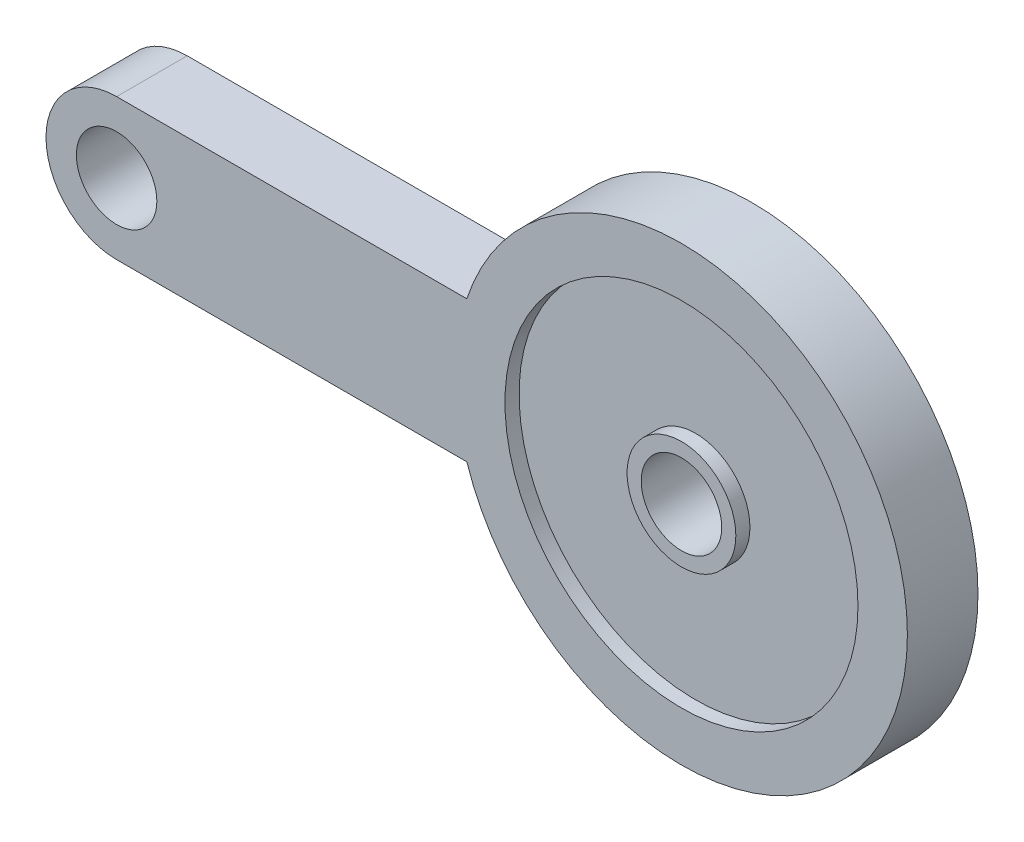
SolidWorks part; units mm, degrees
ref_plane "Front Plane" through (0, 0, 0) normal (0, 0, 1) x (1, 0, 0)
ref_plane "Top Plane" through (0, 0, 0) normal (0, 1, 0) x (1, 0, 0)
ref_plane "Right Plane" through (0, 0, 0) normal (1, 0, 0) x (0, 0, -1)
imported_body "Imported1"
sketch "Sketch1" plane through (0, 0, 2.5) normal (0, 0, 1) x (1, 0, 0)
  line L0 (28.1064, 13.7944) -> (36.8722, 25.1152)
  line L1 (36.8722, 25.1152) -> (61.5599, -12.109)
  line L2 (61.5599, -12.109) -> (17.871, -31.4121)
  line L3 (17.871, -31.4121) -> (13.4901, -14.6158)
  arc A0 (13.4901, -14.6158) -> (28.1064, 13.7944) centre (20, 0) ccw
  arc A1 (30.6565, 11.9348) -> (4.8013, 5) centre (20, 0) ccw construction
extrude "Cut-Extrude1" cut sketch "Sketch1" against normal through all
